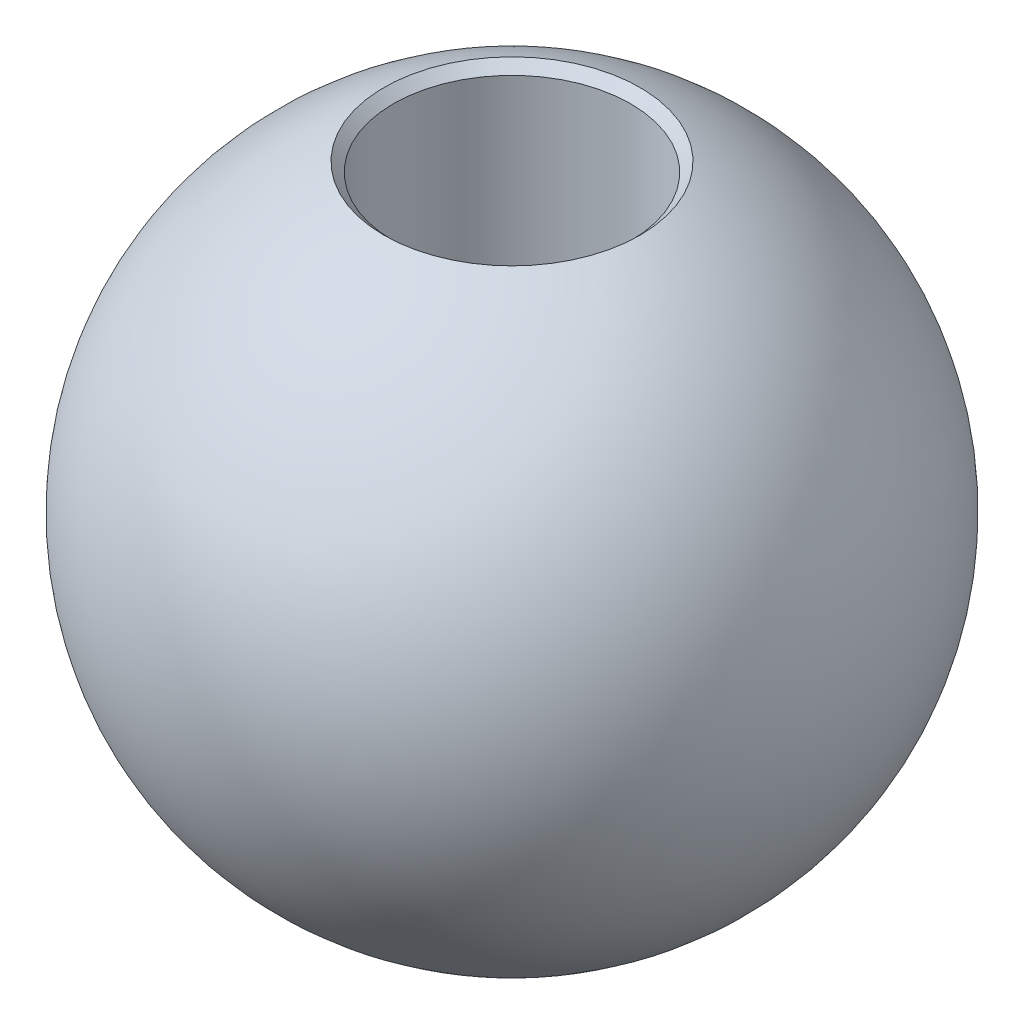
SolidWorks part; units mm, degrees
ref_plane "Face" through (0, 0, 0) normal (0, 0, 1) x (1, 0, 0)
ref_plane "Dessus" through (0, 0, 0) normal (0, 1, 0) x (1, 0, 0)
ref_plane "Droite" through (0, 0, 0) normal (1, 0, 0) x (0, 0, -1)
sketch "Esquisse1" plane through (0, 0, 0) normal (0, 0, 1) x (1, 0, 0)
  line L0 (0, 12.5) -> (0, -12.5)
  line L1 (0, 24.649) -> (0, -18.768) construction
  arc A0 (0, -12.5) -> (0, 12.5) centre (0, 0) ccw
  point P4 (0, 0)
  dimension "D1" = 25
revolve "Base-Révolution" add sketch "Esquisse1" angle 360 about L1
sketch "Esquisse2" plane through (0, 0, 0) normal (0, 1, 0) x (1, 0, 0)
  circle A0 centre (0, 0) radius 4.5
  dimension "D1" = 9
extrude "Enlèv. mat.-Extru.1" cut sketch "Esquisse2" against normal through all and the other way through all
chamfer "Chanfrein1" distance 0.5 angle 45
